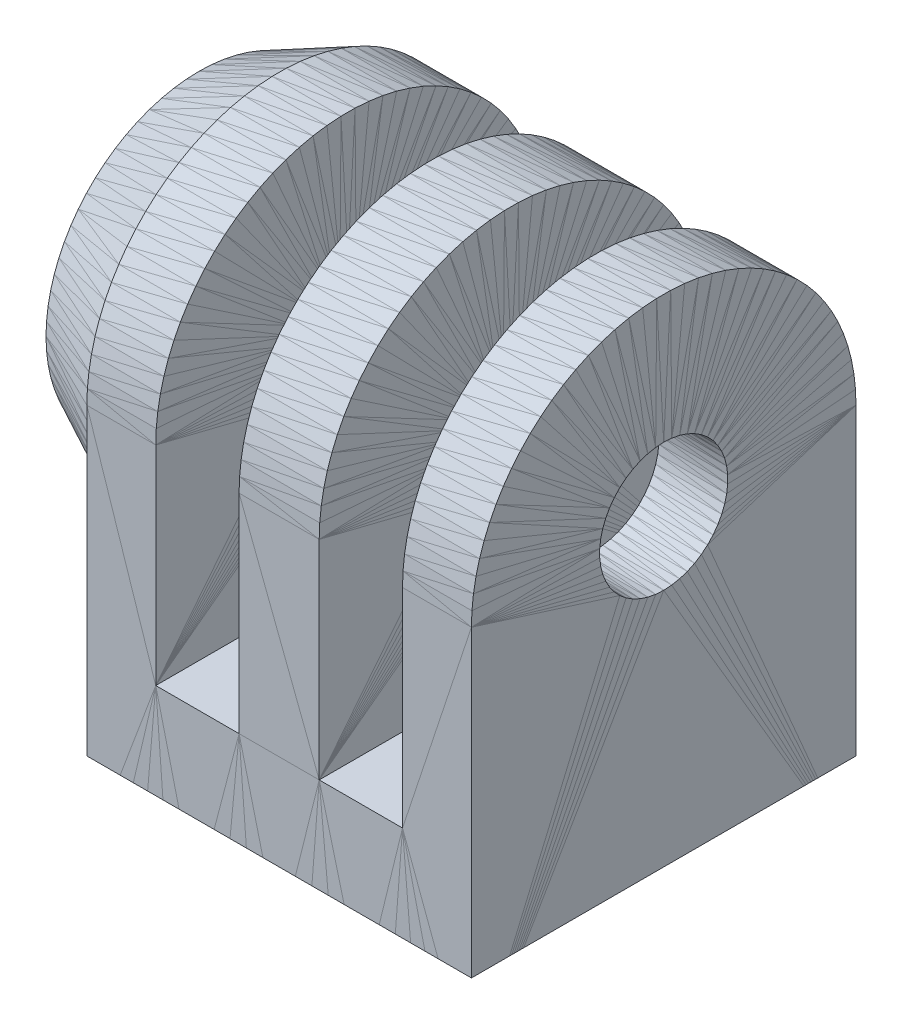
SolidWorks part; units mm, degrees
ref_plane "前视基准面" through (0, 0, 0) normal (0, 0, 1) x (1, 0, 0)
ref_plane "上视基准面" through (0, 0, 0) normal (0, 1, 0) x (1, 0, 0)
ref_plane "右视基准面" through (0, 0, 0) normal (1, 0, 0) x (0, 0, -1)
imported_body "输入2"
sketch "草图2" plane through (0, 30.607, 0) normal (0, -1, 0) x (1, 0, 0)
  line L1 (205.3726, 25.4) -> (266.2179, 25.4)
  line L2 (205.3726, 25.4) -> (205.3726, 0)
  line L3 (205.3726, 0) -> (266.2179, 0)
  line L4 (266.2179, 25.4) -> (266.2179, 0)
extrude "切除-拉伸3" cut sketch "草图2" against normal blind 30
sketch "草图6" plane through (228.1753, 0, 0) normal (-1, 0, 0) x (0, 0, 1)
  circle A0 centre (12.7, 72.644) radius 2.54
sketch "草图7" plane through (0, 60.607, 0) normal (0, -1, 0) x (1, 0, 0)
  line L1 (228.1753, 20.32) -> (243.4153, 20.32)
  line L2 (228.1753, 20.32) -> (228.1753, 5.08)
  line L3 (228.1753, 5.08) -> (243.4153, 5.08)
  line L4 (243.4153, 20.32) -> (243.4153, 5.08)
